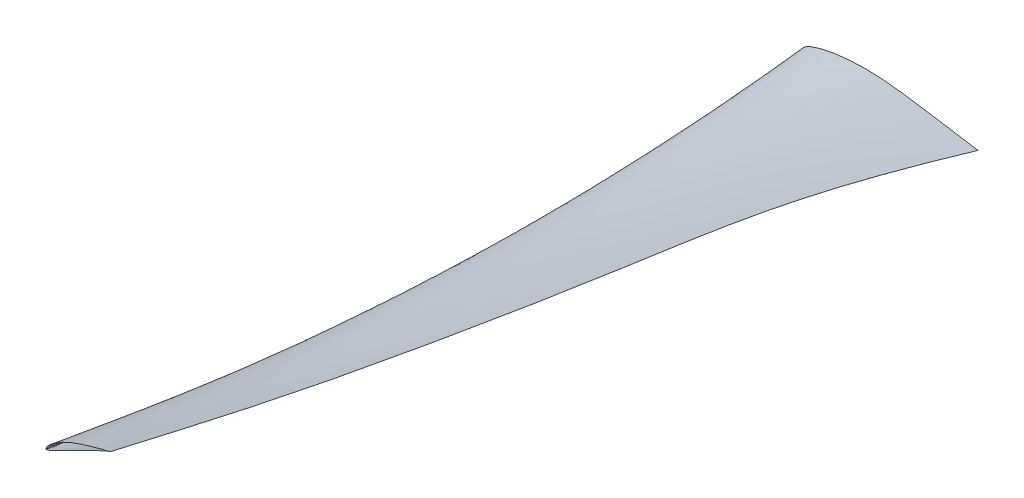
SolidWorks part; units mm, degrees
ref_plane "Plan de face" through (0, 0, 0) normal (0, 0, 1) x (1, 0, 0)
ref_plane "Plan de dessus" through (0, 0, 0) normal (0, 1, 0) x (1, 0, 0)
ref_plane "Plan de droite" through (0, 0, 0) normal (1, 0, 0) x (0, 0, -1)
ref_plane "Plan7" through (0, 0, 0) normal (0, 0, 1) x (1, 0, 0)
sketch "Esquisse7" plane through (0, 0, 0) normal (0, 0, 1) x (1, 0, 0)
  spline S0 degree 3 poles (0, 0) (0.01, 0.0779) (0.0566, 0.4389) (0.6038, 1.0375) (1.4835, 1.8363) (2.8511, 2.6404) (4.5884, 3.488) (6.7468, 4.3064) (9.2893, 5.0773) (12.1913, 5.8344) (15.4386, 6.4858) (18.9898, 7.0761) (22.8127, 7.5599) (26.8712, 7.9384) (31.13, 8.1902) (35.5567, 8.2799) (40.1224, 8.1907) (44.8051, 7.965) (49.5765, 7.5702) (54.409, 7.0333) (59.2707, 6.3995) (64.1131, 5.711) (68.879, 4.9915) (73.5011, 4.2633) (77.92, 3.5536) (82.0778, 2.8904) (85.909, 2.2574) (89.3679, 1.7074) (92.3959, 1.2022) (94.9606, 0.7907) (97.0187, 0.4452) (98.5362, 0.2104) (99.4689, 0.0649) (99.8933, 0.013) (100, 0) knots 0 0 0 0 0.002279 0.010565 0.02232 0.037625 0.05653 0.079028 0.105089 0.134331 0.166822 0.202049 0.239744 0.279649 0.321405 0.364661 0.409281 0.455122 0.50194 0.549472 0.597507 0.645525 0.692715 0.738665 0.78256 0.823791 0.861972 0.896286 0.926362 0.95188 0.972359 0.987477 0.996852 1 1 1 1
  spline S1 degree 3 poles (0, 0) (0.0216, -0.1028) (0.0957, -0.4562) (0.906, -0.754) (2.0288, -1.0924) (3.7758, -1.3043) (5.9941, -1.458) (8.7342, -1.512) (11.9532, -1.5081) (15.6306, -1.4432) (19.7237, -1.331) (24.1903, -1.1785) (28.9802, -0.9996) (34.0362, -0.7913) (39.3002, -0.6124) (44.7029, -0.4031) (50.183, -0.2273) (55.6731, -0.0668) (61.1032, 0.07) (66.4063, 0.1967) (71.5165, 0.2722) (76.3699, 0.3249) (80.9033, 0.3414) (85.0567, 0.3468) (88.7835, 0.3163) (92.0301, 0.2654) (94.7571, 0.2109) (96.9234, 0.1366) (98.5004, 0.0831) (99.4602, 0.0331) (99.89, 0.0068) (100, 0) knots 0 0 0 0 0.003023 0.010401 0.022533 0.03974 0.062002 0.089293 0.121454 0.1582 0.199139 0.243771 0.291698 0.342319 0.394926 0.44903 0.503823 0.558709 0.613093 0.666078 0.717164 0.765757 0.811062 0.852583 0.889823 0.922387 0.949576 0.971293 0.987136 0.996708 1 1 1 1
ref_plane "Plan8" through (0, 0, 100) normal (0, 0, 1) x (1, 0, 0)
sketch "Esquisse8" plane through (0, 0, 100) normal (0, 0, 1) x (1, 0, 0)
  line L0 (0, 0) -> (19.9239, 1.7431) construction
  line L1 (19.9239, 1.7431) -> (19.0523, 11.7051) construction
  line L2 (0, 0) -> (19.9239, 1.7431) construction
  line L3 (19.9239, 1.7431) -> (19.0523, 11.7051) construction
  spline S0 degree 3 poles (19.0523, 11.7051) (19.0546, 11.7605) (19.0651, 12.0177) (19.4137, 12.4731) (19.9842, 13.09) (20.8979, 13.7407) (22.0695, 14.4449) (23.5395, 15.1543) (25.283, 15.8541) (27.2805, 16.5662) (29.5278, 17.2252) (31.993, 17.8599) (34.6561, 18.4363) (37.4916, 18.953) (40.4761, 19.3928) (43.5887, 19.7288) (46.8104, 19.9474) (50.1229, 20.077) (53.5083, 20.0929) (56.9454, 20.0126) (60.4092, 19.8657) (63.8627, 19.6792) (67.2642, 19.4661) (70.5649, 19.2379) (73.7215, 19.0104) (76.6911, 18.7994) (79.4289, 18.5897) (81.8993, 18.4154) (84.0634, 18.2461) (85.8954, 18.1143) (87.3664, 17.9978) (88.4498, 17.9259) (89.1158, 17.8809) (89.418, 17.8705) (89.4939, 17.8679) knots 0 0 0 0 0.002279 0.010565 0.02232 0.037625 0.05653 0.079028 0.105089 0.134331 0.166822 0.202049 0.239744 0.279649 0.321405 0.364661 0.409281 0.455122 0.50194 0.549472 0.597507 0.645525 0.692715 0.738665 0.78256 0.823791 0.861972 0.896286 0.926362 0.95188 0.972359 0.987477 0.996852 1 1 1 1
  spline S1 degree 3 poles (19.0523, 11.7051) (19.0739, 11.634) (19.1479, 11.3896) (19.737, 11.2298) (20.5488, 11.0606) (21.7925, 11.019) (23.3645, 11.0474) (25.298, 11.1782) (27.5653, 11.3794) (30.1517, 11.6517) (33.0281, 11.983) (36.165, 12.3657) (39.5281, 12.7869) (43.0768, 13.2453) (46.7738, 13.6957) (50.5666, 14.1761) (54.4161, 14.6376) (58.2734, 15.0891) (62.0901, 15.5201) (65.8179, 15.9361) (69.4129, 16.3043) (72.8285, 16.6405) (76.0209, 16.9315) (78.9463, 17.1912) (81.5734, 17.3994) (83.8635, 17.5637) (85.7877, 17.6934) (87.3183, 17.7745) (88.4325, 17.834) (89.1116, 17.858) (89.416, 17.8659) (89.4939, 17.8679) knots 0 0 0 0 0.003023 0.010401 0.022533 0.03974 0.062002 0.089293 0.121454 0.1582 0.199139 0.243771 0.291698 0.342319 0.394926 0.44903 0.503823 0.558709 0.613093 0.666078 0.717164 0.765757 0.811062 0.852583 0.889823 0.922387 0.949576 0.971293 0.987136 0.996708 1 1 1 1
ref_plane "Plan9" through (0, 0, 200) normal (0, 0, 1) x (1, 0, 0)
sketch "Esquisse9" plane through (0, 0, 200) normal (0, 0, 1) x (1, 0, 0)
  line L0 (0, 0) -> (39.3923, 6.9459) construction
  line L1 (39.3923, 6.9459) -> (35.9193, 26.6421) construction
  line L2 (0, 0) -> (39.3923, 6.9459) construction
  line L3 (39.3923, 6.9459) -> (35.9193, 26.6421) construction
  spline S0 degree 3 poles (35.9193, 26.6421) (35.9172, 26.6874) (35.9075, 26.8973) (36.1586, 27.2925) (36.5787, 27.8349) (37.2757, 28.4292) (38.1785, 29.0853) (39.3237, 29.767) (40.692, 30.4602) (42.2661, 31.1816) (44.0472, 31.8776) (46.0071, 32.5693) (48.1323, 33.2276) (50.4019, 33.8497) (52.7981, 34.4198) (55.306, 34.9146) (57.9109, 35.3216) (60.5961, 35.6628) (63.3486, 35.9166) (66.15, 36.0959) (68.9778, 36.2229) (71.8001, 36.317) (74.582, 36.3857) (77.2831, 36.435) (79.8668, 36.4745) (82.2973, 36.5143) (84.5391, 36.5385) (86.5609, 36.5725) (88.3332, 36.5888) (89.8327, 36.612) (91.0375, 36.6219) (91.9238, 36.6405) (92.4687, 36.6513) (92.7153, 36.6644) (92.7772, 36.6677) knots 0 0 0 0 0.002279 0.010565 0.02232 0.037625 0.05653 0.079028 0.105089 0.134331 0.166822 0.202049 0.239744 0.279649 0.321405 0.364661 0.409281 0.455122 0.50194 0.549472 0.597507 0.645525 0.692715 0.738665 0.78256 0.823791 0.861972 0.896286 0.926362 0.95188 0.972359 0.987477 0.996852 1 1 1 1
  spline S1 degree 3 poles (35.9193, 26.6421) (35.9419, 26.5858) (36.0195, 26.3923) (36.51, 26.3042) (37.1824, 26.2243) (38.197, 26.2791) (39.4736, 26.414) (41.037, 26.658) (42.8669, 26.983) (44.9513, 27.3886) (47.2673, 27.8627) (49.7916, 28.3972) (52.4971, 28.9791) (55.351, 29.6045) (58.326, 30.2339) (61.3769, 30.8946) (64.4752, 31.544) (67.5806, 32.1857) (70.6543, 32.8078) (73.6568, 33.4115) (76.5548, 33.9668) (79.3091, 34.4833) (81.885, 34.9472) (84.246, 35.3667) (86.3681, 35.723) (88.2192, 36.0195) (89.7751, 36.2619) (91.0143, 36.4369) (91.9163, 36.5646) (92.467, 36.6324) (92.714, 36.6605) (92.7772, 36.6677) knots 0 0 0 0 0.003023 0.010401 0.022533 0.03974 0.062002 0.089293 0.121454 0.1582 0.199139 0.243771 0.291698 0.342319 0.394926 0.44903 0.503823 0.558709 0.613093 0.666078 0.717164 0.765757 0.811062 0.852583 0.889823 0.922387 0.949576 0.971293 0.987136 0.996708 1 1 1 1
ref_plane "Plan10" through (0, 0, 300) normal (0, 0, 1) x (1, 0, 0)
sketch "Esquisse10" plane through (0, 0, 300) normal (0, 0, 1) x (1, 0, 0)
  line L0 (0, 0) -> (57.9555, 15.5291) construction
  line L1 (57.9555, 15.5291) -> (50.191, 44.5069) construction
  line L2 (0, 0) -> (57.9555, 15.5291) construction
  line L3 (57.9555, 15.5291) -> (50.191, 44.5069) construction
  spline S0 degree 3 poles (50.191, 44.5069) (50.1857, 44.5458) (50.1615, 44.7262) (50.3483, 45.0861) (50.6698, 45.5857) (51.2262, 46.1511) (51.9556, 46.7853) (52.8922, 47.4598) (54.0203, 48.1612) (55.3239, 48.9024) (56.8079, 49.6372) (58.4466, 50.3819) (60.2303, 51.1103) (62.1415, 51.8183) (64.1657, 52.491) (66.292, 53.1072) (68.5087, 53.6549) (70.7994, 54.1519) (73.1549, 54.5787) (75.5583, 54.9448) (77.9884, 55.2678) (80.4162, 55.562) (82.811, 55.8312) (85.1376, 56.0777) (87.3636, 56.3068) (89.4575, 56.5245) (91.3897, 56.7146) (93.1314, 56.8966) (94.6592, 57.0444) (95.9511, 57.1776) (96.9898, 57.2771) (97.7531, 57.36) (98.2223, 57.4105) (98.434, 57.4404) (98.4873, 57.4479) knots 0 0 0 0 0.002279 0.010565 0.02232 0.037625 0.05653 0.079028 0.105089 0.134331 0.166822 0.202049 0.239744 0.279649 0.321405 0.364661 0.409281 0.455122 0.50194 0.549472 0.597507 0.645525 0.692715 0.738665 0.78256 0.823791 0.861972 0.896286 0.926362 0.95188 0.972359 0.987477 0.996852 1 1 1 1
  spline S1 degree 3 poles (50.191, 44.5069) (50.2147, 44.4601) (50.2962, 44.299) (50.7261, 44.26) (51.3122, 44.2419) (52.1833, 44.3656) (53.2746, 44.5784) (54.6049, 44.907) (56.1591, 45.3254) (57.9267, 45.8326) (59.8891, 46.4165) (62.0265, 47.0682) (64.3167, 47.7744) (66.7316, 48.5294) (69.2508, 49.297) (71.833, 50.0972) (74.4569, 50.8913) (77.0876, 51.6793) (79.6925, 52.4481) (82.2373, 53.1955) (84.6956, 53.8933) (87.0328, 54.5468) (89.2201, 55.1415) (91.2253, 55.6815) (93.0292, 56.1491) (94.6038, 56.5447) (95.9278, 56.8712) (96.9837, 57.1157) (97.7523, 57.2939) (98.2223, 57.394) (98.4333, 57.4369) (98.4873, 57.4479) knots 0 0 0 0 0.003023 0.010401 0.022533 0.03974 0.062002 0.089293 0.121454 0.1582 0.199139 0.243771 0.291698 0.342319 0.394926 0.44903 0.503823 0.558709 0.613093 0.666078 0.717164 0.765757 0.811062 0.852583 0.889823 0.922387 0.949576 0.971293 0.987136 0.996708 1 1 1 1
ref_plane "Plan11" through (0, 0, 400) normal (0, 0, 1) x (1, 0, 0)
sketch "Esquisse11" plane through (0, 0, 400) normal (0, 0, 1) x (1, 0, 0)
  line L0 (0, 0) -> (75.1754, 27.3616) construction
  line L1 (75.1754, 27.3616) -> (61.4946, 64.9493) construction
  line L2 (0, 0) -> (75.1754, 27.3616) construction
  line L3 (75.1754, 27.3616) -> (61.4946, 64.9493) construction
  spline S0 degree 3 poles (61.4946, 64.9493) (61.4869, 64.9836) (61.4513, 65.1424) (61.5896, 65.4777) (61.8372, 65.9479) (62.2889, 66.495) (62.8893, 67.117) (63.6712, 67.791) (64.6218, 68.5039) (65.7255, 69.2659) (66.9905, 70.0364) (68.3926, 70.8276) (69.9252, 71.6157) (71.5728, 72.3955) (73.324, 73.1527) (75.1706, 73.8675) (77.103, 74.5284) (79.1054, 75.1498) (81.1709, 75.7136) (83.2838, 76.2272) (85.4239, 76.7045) (87.5642, 77.1558) (89.677, 77.5824) (91.7308, 77.9834) (93.6964, 78.361) (95.5452, 78.7183) (97.252, 79.0383) (98.7897, 79.3362) (100.1395, 79.587) (101.2802, 79.8064) (102.198, 79.976) (102.8716, 80.1094) (103.2858, 80.191) (103.4721, 80.2341) (103.5189, 80.2449) knots 0 0 0 0 0.002279 0.010565 0.02232 0.037625 0.05653 0.079028 0.105089 0.134331 0.166822 0.202049 0.239744 0.279649 0.321405 0.364661 0.409281 0.455122 0.50194 0.549472 0.597507 0.645525 0.692715 0.738665 0.78256 0.823791 0.861972 0.896286 0.926362 0.95188 0.972359 0.987477 0.996852 1 1 1 1
  spline S1 degree 3 poles (61.4946, 64.9493) (61.5194, 64.9094) (61.6046, 64.7722) (61.9906, 64.771) (62.5143, 64.8005) (63.2809, 64.9787) (64.2366, 65.2534) (65.3964, 65.6499) (66.7485, 66.1439) (68.284, 66.7336) (69.987, 67.4068) (71.8407, 68.1541) (73.8263, 68.9619) (75.9191, 69.8228) (78.1039, 70.7032) (80.3423, 71.6175) (82.6185, 72.5296) (84.901, 73.4368) (87.1621, 74.3248) (89.3713, 75.1892) (91.5073, 76.0026) (93.5388, 76.7671) (95.4415, 77.4674) (97.1861, 78.105) (98.7569, 78.6622) (100.1291, 79.1374) (101.2834, 79.5316) (102.2051, 79.8317) (102.876, 80.0505) (103.287, 80.1763) (103.4717, 80.2309) (103.5189, 80.2449) knots 0 0 0 0 0.003023 0.010401 0.022533 0.03974 0.062002 0.089293 0.121454 0.1582 0.199139 0.243771 0.291698 0.342319 0.394926 0.44903 0.503823 0.558709 0.613093 0.666078 0.717164 0.765757 0.811062 0.852583 0.889823 0.922387 0.949576 0.971293 0.987136 0.996708 1 1 1 1
ref_plane "Plan12" through (0, 0, 500) normal (0, 0, 1) x (1, 0, 0)
sketch "Esquisse12" plane through (0, 0, 500) normal (0, 0, 1) x (1, 0, 0)
  line L0 (0, 0) -> (90.6308, 42.2618) construction
  line L1 (90.6308, 42.2618) -> (69.4999, 87.5772) construction
  line L2 (0, 0) -> (90.6308, 42.2618) construction
  line L3 (90.6308, 42.2618) -> (69.4999, 87.5772) construction
  spline S0 degree 3 poles (69.4999, 87.5772) (69.4901, 87.6078) (69.4451, 87.7494) (69.5443, 88.0653) (69.7319, 88.5126) (70.0992, 89.0461) (70.5958, 89.6594) (71.2532, 90.3346) (72.0609, 91.0585) (73.004, 91.8393) (74.0931, 92.6406) (75.3052, 93.4717) (76.6362, 94.3103) (78.0725, 95.1506) (79.6048, 95.9785) (81.2272, 96.7755) (82.9319, 97.5302) (84.7035, 98.2546) (86.537, 98.9318) (88.4176, 99.5669) (90.3258, 100.1712) (92.2363, 100.7519) (94.1238, 101.308) (95.9596, 101.836) (97.7171, 102.3358) (99.3698, 102.8078) (100.8966, 103.2346) (102.2713, 103.6279) (103.4788, 103.9634) (104.4987, 104.2536) (105.3198, 104.4809) (105.9218, 104.6558) (106.292, 104.7629) (106.458, 104.8169) (106.4997, 104.8305) knots 0 0 0 0 0.002279 0.010565 0.02232 0.037625 0.05653 0.079028 0.105089 0.134331 0.166822 0.202049 0.239744 0.279649 0.321405 0.364661 0.409281 0.455122 0.50194 0.549472 0.597507 0.645525 0.692715 0.738665 0.78256 0.823791 0.861972 0.896286 0.926362 0.95188 0.972359 0.987477 0.996852 1 1 1 1
  spline S1 degree 3 poles (69.4999, 87.5772) (69.5256, 87.5429) (69.614, 87.4249) (69.9651, 87.4546) (70.439, 87.523) (71.1219, 87.7461) (71.9692, 88.0719) (72.9924, 88.5247) (74.1827, 89.0816) (75.5322, 89.74) (77.0273, 90.4877) (78.6536, 91.3148) (80.395, 92.2074) (82.2297, 93.1568) (84.1466, 94.1312) (86.1094, 95.1408) (88.1067, 96.1514) (90.1103, 97.158) (92.0959, 98.1454) (94.0362, 99.1073) (95.9139, 100.0169) (97.7006, 100.8738) (99.3751, 101.662) (100.9109, 102.3806) (102.2951, 103.0123) (103.5051, 103.5537) (104.5235, 104.004) (105.3378, 104.3503) (105.9305, 104.6026) (106.2943, 104.7497) (106.4579, 104.8141) (106.4997, 104.8305) knots 0 0 0 0 0.003023 0.010401 0.022533 0.03974 0.062002 0.089293 0.121454 0.1582 0.199139 0.243771 0.291698 0.342319 0.394926 0.44903 0.503823 0.558709 0.613093 0.666078 0.717164 0.765757 0.811062 0.852583 0.889823 0.922387 0.949576 0.971293 0.987136 0.996708 1 1 1 1
surface "Surface-Lissage1"
sketch3d "Esquisse3D1"
  line L0 (0, 0, 0) -> (0, 0, 750.9809)
  line L1 (0, 0, 0) -> (0, 158.2448, 0)
  line L2 (0, 0, 0) -> (185.0969, 0, 0)
